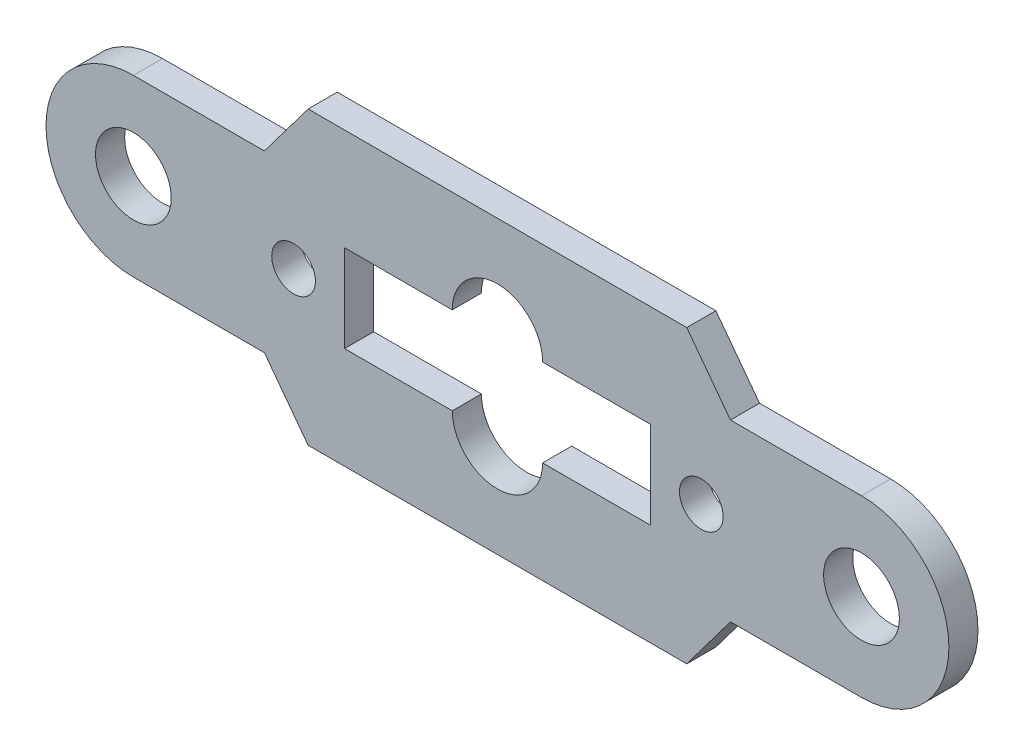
SolidWorks part; units mm, degrees
ref_plane "Face" through (0, 0, 0) normal (0, 0, 1) x (1, 0, 0)
ref_plane "Dessus" through (0, 0, 0) normal (0, 1, 0) x (1, 0, 0)
ref_plane "Droite" through (0, 0, 0) normal (1, 0, 0) x (0, 0, -1)
sketch "Esquisse1" plane through (0, 0, 0) normal (0, 0, 1) x (1, 0, 0)
  line L0 (0, 0) -> (0, 5)
  line L1 (0, 5) -> (6.5, 5)
  line L2 (6.5, 5) -> (8, 3)
  line L3 (8, 3) -> (12.5, 3)
  line L4 (0, 0) -> (15.5, 0)
  arc A0 (12.5, 3) -> (15.5, 0) centre (12.5, 0) cw
  dimension "D1" = 3
  dimension "D2" = 15.5
  dimension "D3" = 6.5
  dimension "D4" = 8
  dimension "D5" = 5
extrude "Extrusion1" add sketch "Esquisse1" along normal blind 1
sketch "Esquisse2" plane through (0, 0, 1) normal (0, 0, 1) x (1, 0, 0)
  line L0 (0, 0) -> (15.5, 0) construction
  line L1 (0, 0) -> (5.25, 0)
  line L2 (0, 0) -> (0, -0.05)
  line L3 (1.55, 1.5) -> (5.25, 1.5)
  line L4 (5.25, 0) -> (5.25, 1.5)
  line L5 (0, 5) -> (0, 0) construction
  circle A0 centre (12.5, 0) radius 1.3
  arc A1 (1.55, 1.5) -> (0, -0.05) centre (0, 1.5) ccw
  circle A2 centre (7, 0) radius 0.75
  dimension "D1" = 2.6
  dimension "D2" = 1.5
  dimension "D5" = 3.1
  dimension "D3" = 5.25
  dimension "D4" = 1.5
  dimension "D6" = 7
extrude "Extrusion2" cut sketch "Esquisse2" against normal through all
mirror "Symétrie1" about plane through (0, 0, 1) normal (0, 1, 0)
mirror "Symétrie2" about plane through (0, 0, 1) normal (1, 0, 0)
